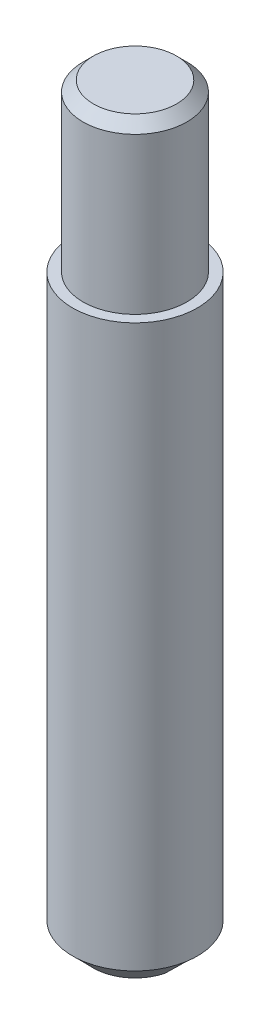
SolidWorks part; units mm, degrees
ref_plane "Front Plane" through (0, 0, 0) normal (0, 0, 1) x (1, 0, 0)
ref_plane "Top Plane" through (0, 0, 0) normal (0, 1, 0) x (1, 0, 0)
ref_plane "Right Plane" through (0, 0, 0) normal (1, 0, 0) x (0, 0, -1)
sketch "Sketch2" plane through (0, 0, 0) normal (0, 1, 0) x (1, 0, 0)
  circle A0 centre (0, 0) radius 3
  dimension "D1" = 6
extrude "Extrude1" add sketch "Sketch2" along normal blind 28
sketch "Sketch3" plane through (0, 28, 0) normal (0, 1, 0) x (1, 0, 0)
  circle A0 centre (0, 0) radius 2.5
  dimension "D1" = 5
extrude "Extrude2" add sketch "Sketch3" along normal blind 8
chamfer "Chamfer1" distance 0.5 angle 45 1 edges at (0, 36, 2.5)
chamfer "Chamfer2" distance 1 angle 45 1 edges at (0, 0, 3)
sketch "Sketch4" plane through (0, 0, 0) normal (0, -1, 0) x (1, 0, 0)
  line L0 (-2, 0) -> (2, 0) construction
  line L1 (-4.0374, -0.5) -> (4.0536, -0.5)
  line L2 (-3.9401, 0.5) -> (3.5347, 0.5)
  line L3 (-2, 0.5) -> (2, 0.5) construction
  line L4 (-2, -0.5) -> (2, -0.5) construction
  line L5 (3.5347, 0.5) -> (4.0536, -0.5)
  line L6 (-3.9401, 0.5) -> (-4.0374, -0.5)
  circle A0 centre (0, 0) radius 2 construction
  dimension "D1" = 0.5
  dimension "D2" = 0.5
extrude "Extrude3" cut sketch "Sketch4" against normal blind 1
